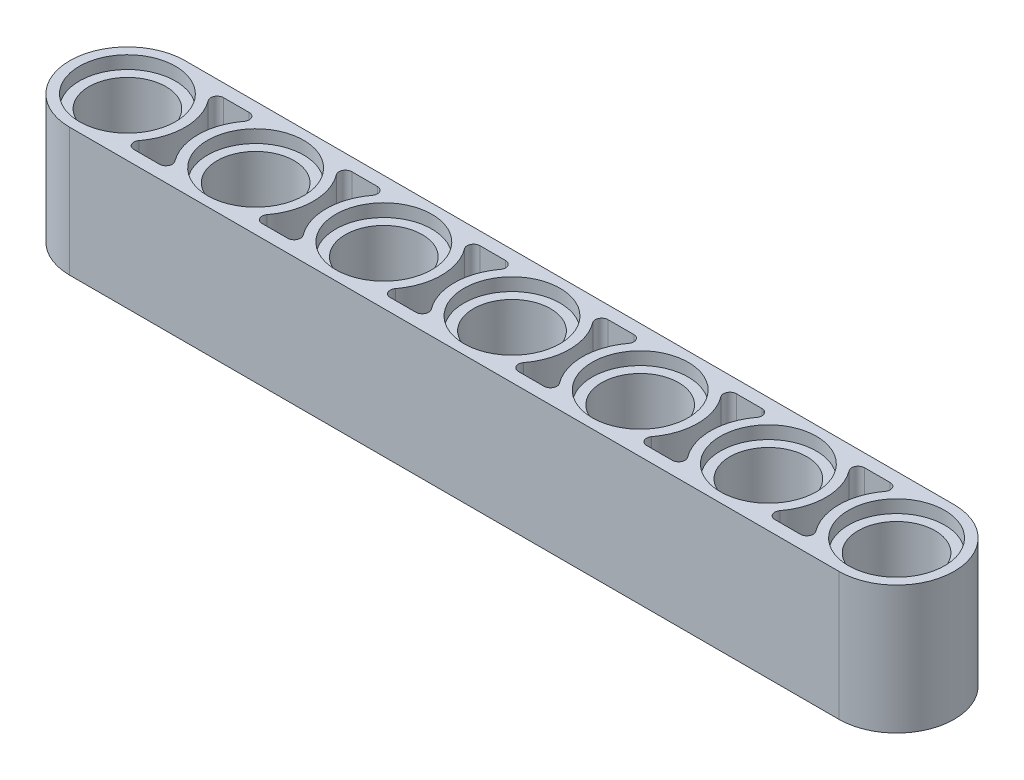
SolidWorks part; units mm, degrees
ref_plane "Front Plane" through (0, 0, 0) normal (0, 0, 1) x (1, 0, 0)
ref_plane "Top Plane" through (0, 0, 0) normal (0, 1, 0) x (1, 0, 0)
ref_plane "Right Plane" through (0, 0, 0) normal (1, 0, 0) x (0, 0, -1)
sketch "Sketch1" plane through (0, 0, 0) normal (0, 1, 0) x (1, 0, 0)
  line L0 (0, 0) -> (8, 0) construction
  line L1 (0, -3.6) -> (112, -3.6)
  line L2 (0, 3.6) -> (112, 3.6)
  circle A0 centre (0, 0) radius 2.4
  circle A1 centre (8, 0) radius 2.4
  circle A2 centre (16, 0) radius 2.4
  circle A3 centre (24, 0) radius 2.4
  circle A4 centre (32, 0) radius 2.4
  circle A5 centre (40, 0) radius 2.4
  circle A6 centre (48, 0) radius 2.4
  circle A7 centre (56, 0) radius 2.4
  circle A8 centre (64, 0) radius 2.4
  circle A9 centre (72, 0) radius 2.4
  circle A10 centre (80, 0) radius 2.4
  circle A11 centre (88, 0) radius 2.4
  circle A12 centre (96, 0) radius 2.4
  circle A13 centre (104, 0) radius 2.4
  circle A14 centre (112, 0) radius 2.4
  arc A15 (112, 3.6) -> (112, -3.6) centre (112, 0) cw
  arc A16 (0, 3.6) -> (0, -3.6) centre (0, 0) ccw
  dimension "D1" = 4.8
  dimension "D2" = 8
  dimension "D3" = 15
  dimension "D4" = 3.6
  dimension "D5" = 3.6
extrude "Boss-Extrude1" add sketch "Sketch1" along normal blind 8
sketch "Sketch2" plane through (0, 8, 0) normal (0, 1, 0) x (1, 0, 0)
  line L0 (0, 0) -> (8, 0) construction
  circle A0 centre (0, 0) radius 3
  circle A1 centre (8, 0) radius 3
  circle A2 centre (16, 0) radius 3
  circle A3 centre (24, 0) radius 3
  circle A4 centre (32, 0) radius 3
  circle A5 centre (40, 0) radius 3
  circle A6 centre (48, 0) radius 3
  circle A7 centre (56, 0) radius 3
  circle A8 centre (64, 0) radius 3
  circle A9 centre (72, 0) radius 3
  circle A10 centre (80, 0) radius 3
  circle A11 centre (88, 0) radius 3
  circle A12 centre (96, 0) radius 3
  circle A13 centre (104, 0) radius 3
  circle A14 centre (112, 0) radius 3
  dimension "D1" = 6
  dimension "D2" = 8
extrude "Cut-Extrude1" cut sketch "Sketch2" against normal blind 0.8
sketch "Sketch3" plane through (0, 8, 0) normal (0, 1, 0) x (1, 0, 0)
  line L0 (3.2, 2.8) -> (4.8, 2.8)
  line L1 (4.8, -2.8) -> (3.2, -2.8)
  line L2 (112, 3.6) -> (0, 3.6) construction
  line L3 (0, -3.6) -> (112, -3.6) construction
  line L4 (11.2, 2.8) -> (12.8, 2.8)
  line L5 (12.8, -2.8) -> (11.2, -2.8)
  line L6 (19.2, 2.8) -> (20.8, 2.8)
  line L7 (20.8, -2.8) -> (19.2, -2.8)
  line L8 (27.2, 2.8) -> (28.8, 2.8)
  line L9 (28.8, -2.8) -> (27.2, -2.8)
  line L10 (35.2, 2.8) -> (36.8, 2.8)
  line L11 (36.8, -2.8) -> (35.2, -2.8)
  line L12 (43.2, 2.8) -> (44.8, 2.8)
  line L13 (44.8, -2.8) -> (43.2, -2.8)
  line L14 (51.2, 2.8) -> (52.8, 2.8)
  line L15 (52.8, -2.8) -> (51.2, -2.8)
  line L16 (59.2, 2.8) -> (60.8, 2.8)
  line L17 (60.8, -2.8) -> (59.2, -2.8)
  line L18 (67.2, 2.8) -> (68.8, 2.8)
  line L19 (68.8, -2.8) -> (67.2, -2.8)
  line L20 (75.2, 2.8) -> (76.8, 2.8)
  line L21 (76.8, -2.8) -> (75.2, -2.8)
  line L22 (83.2, 2.8) -> (84.8, 2.8)
  line L23 (84.8, -2.8) -> (83.2, -2.8)
  line L24 (91.2, 2.8) -> (92.8, 2.8)
  line L25 (92.8, -2.8) -> (91.2, -2.8)
  line L26 (99.2, 2.8) -> (100.8, 2.8)
  line L27 (100.8, -2.8) -> (99.2, -2.8)
  line L28 (107.2, 2.8) -> (108.8, 2.8)
  line L29 (108.8, -2.8) -> (107.2, -2.8)
  line L30 (3.2, 2.8) -> (11.2, 2.8) construction
  arc A0 (2.88, -2.16) -> (2.88, 2.16) centre (0, 0) ccw
  arc A1 (5.12, 2.16) -> (5.12, -2.16) centre (8, 0) ccw
  arc A2 (3.2, -2.8) -> (2.88, -2.16) centre (3.2, -2.4) cw
  arc A3 (5.12, -2.16) -> (4.8, -2.8) centre (4.8, -2.4) cw
  arc A4 (5.12, 2.16) -> (4.8, 2.8) centre (4.8, 2.4) ccw
  arc A5 (3.2, 2.8) -> (2.88, 2.16) centre (3.2, 2.4) ccw
  arc A6 (10.88, -2.16) -> (10.88, 2.16) centre (8, 0) ccw
  arc A7 (13.12, 2.16) -> (13.12, -2.16) centre (16, 0) ccw
  arc A8 (11.2, -2.8) -> (10.88, -2.16) centre (11.2, -2.4) cw
  arc A9 (13.12, -2.16) -> (12.8, -2.8) centre (12.8, -2.4) cw
  arc A10 (13.12, 2.16) -> (12.8, 2.8) centre (12.8, 2.4) ccw
  arc A11 (11.2, 2.8) -> (10.88, 2.16) centre (11.2, 2.4) ccw
  arc A12 (18.88, -2.16) -> (18.88, 2.16) centre (16, 0) ccw
  arc A13 (21.12, 2.16) -> (21.12, -2.16) centre (24, 0) ccw
  arc A14 (19.2, -2.8) -> (18.88, -2.16) centre (19.2, -2.4) cw
  arc A15 (21.12, -2.16) -> (20.8, -2.8) centre (20.8, -2.4) cw
  arc A16 (21.12, 2.16) -> (20.8, 2.8) centre (20.8, 2.4) ccw
  arc A17 (19.2, 2.8) -> (18.88, 2.16) centre (19.2, 2.4) ccw
  arc A18 (26.88, -2.16) -> (26.88, 2.16) centre (24, 0) ccw
  arc A19 (29.12, 2.16) -> (29.12, -2.16) centre (32, 0) ccw
  arc A20 (27.2, -2.8) -> (26.88, -2.16) centre (27.2, -2.4) cw
  arc A21 (29.12, -2.16) -> (28.8, -2.8) centre (28.8, -2.4) cw
  arc A22 (29.12, 2.16) -> (28.8, 2.8) centre (28.8, 2.4) ccw
  arc A23 (27.2, 2.8) -> (26.88, 2.16) centre (27.2, 2.4) ccw
  arc A24 (34.88, -2.16) -> (34.88, 2.16) centre (32, 0) ccw
  arc A25 (37.12, 2.16) -> (37.12, -2.16) centre (40, 0) ccw
  arc A26 (35.2, -2.8) -> (34.88, -2.16) centre (35.2, -2.4) cw
  arc A27 (37.12, -2.16) -> (36.8, -2.8) centre (36.8, -2.4) cw
  arc A28 (37.12, 2.16) -> (36.8, 2.8) centre (36.8, 2.4) ccw
  arc A29 (35.2, 2.8) -> (34.88, 2.16) centre (35.2, 2.4) ccw
  arc A30 (42.88, -2.16) -> (42.88, 2.16) centre (40, 0) ccw
  arc A31 (45.12, 2.16) -> (45.12, -2.16) centre (48, 0) ccw
  arc A32 (43.2, -2.8) -> (42.88, -2.16) centre (43.2, -2.4) cw
  arc A33 (45.12, -2.16) -> (44.8, -2.8) centre (44.8, -2.4) cw
  arc A34 (45.12, 2.16) -> (44.8, 2.8) centre (44.8, 2.4) ccw
  arc A35 (43.2, 2.8) -> (42.88, 2.16) centre (43.2, 2.4) ccw
  arc A36 (50.88, -2.16) -> (50.88, 2.16) centre (48, 0) ccw
  arc A37 (53.12, 2.16) -> (53.12, -2.16) centre (56, 0) ccw
  arc A38 (51.2, -2.8) -> (50.88, -2.16) centre (51.2, -2.4) cw
  arc A39 (53.12, -2.16) -> (52.8, -2.8) centre (52.8, -2.4) cw
  arc A40 (53.12, 2.16) -> (52.8, 2.8) centre (52.8, 2.4) ccw
  arc A41 (51.2, 2.8) -> (50.88, 2.16) centre (51.2, 2.4) ccw
  arc A42 (58.88, -2.16) -> (58.88, 2.16) centre (56, 0) ccw
  arc A43 (61.12, 2.16) -> (61.12, -2.16) centre (64, 0) ccw
  arc A44 (59.2, -2.8) -> (58.88, -2.16) centre (59.2, -2.4) cw
  arc A45 (61.12, -2.16) -> (60.8, -2.8) centre (60.8, -2.4) cw
  arc A46 (61.12, 2.16) -> (60.8, 2.8) centre (60.8, 2.4) ccw
  arc A47 (59.2, 2.8) -> (58.88, 2.16) centre (59.2, 2.4) ccw
  arc A48 (66.88, -2.16) -> (66.88, 2.16) centre (64, 0) ccw
  arc A49 (69.12, 2.16) -> (69.12, -2.16) centre (72, 0) ccw
  arc A50 (67.2, -2.8) -> (66.88, -2.16) centre (67.2, -2.4) cw
  arc A51 (69.12, -2.16) -> (68.8, -2.8) centre (68.8, -2.4) cw
  arc A52 (69.12, 2.16) -> (68.8, 2.8) centre (68.8, 2.4) ccw
  arc A53 (67.2, 2.8) -> (66.88, 2.16) centre (67.2, 2.4) ccw
  arc A54 (74.88, -2.16) -> (74.88, 2.16) centre (72, 0) ccw
  arc A55 (77.12, 2.16) -> (77.12, -2.16) centre (80, 0) ccw
  arc A56 (75.2, -2.8) -> (74.88, -2.16) centre (75.2, -2.4) cw
  arc A57 (77.12, -2.16) -> (76.8, -2.8) centre (76.8, -2.4) cw
  arc A58 (77.12, 2.16) -> (76.8, 2.8) centre (76.8, 2.4) ccw
  arc A59 (75.2, 2.8) -> (74.88, 2.16) centre (75.2, 2.4) ccw
  arc A60 (82.88, -2.16) -> (82.88, 2.16) centre (80, 0) ccw
  arc A61 (85.12, 2.16) -> (85.12, -2.16) centre (88, 0) ccw
  arc A62 (83.2, -2.8) -> (82.88, -2.16) centre (83.2, -2.4) cw
  arc A63 (85.12, -2.16) -> (84.8, -2.8) centre (84.8, -2.4) cw
  arc A64 (85.12, 2.16) -> (84.8, 2.8) centre (84.8, 2.4) ccw
  arc A65 (83.2, 2.8) -> (82.88, 2.16) centre (83.2, 2.4) ccw
  arc A66 (90.88, -2.16) -> (90.88, 2.16) centre (88, 0) ccw
  arc A67 (93.12, 2.16) -> (93.12, -2.16) centre (96, 0) ccw
  arc A68 (91.2, -2.8) -> (90.88, -2.16) centre (91.2, -2.4) cw
  arc A69 (93.12, -2.16) -> (92.8, -2.8) centre (92.8, -2.4) cw
  arc A70 (93.12, 2.16) -> (92.8, 2.8) centre (92.8, 2.4) ccw
  arc A71 (91.2, 2.8) -> (90.88, 2.16) centre (91.2, 2.4) ccw
  arc A72 (98.88, -2.16) -> (98.88, 2.16) centre (96, 0) ccw
  arc A73 (101.12, 2.16) -> (101.12, -2.16) centre (104, 0) ccw
  arc A74 (99.2, -2.8) -> (98.88, -2.16) centre (99.2, -2.4) cw
  arc A75 (101.12, -2.16) -> (100.8, -2.8) centre (100.8, -2.4) cw
  arc A76 (101.12, 2.16) -> (100.8, 2.8) centre (100.8, 2.4) ccw
  arc A77 (99.2, 2.8) -> (98.88, 2.16) centre (99.2, 2.4) ccw
  arc A78 (106.88, -2.16) -> (106.88, 2.16) centre (104, 0) ccw
  arc A79 (109.12, 2.16) -> (109.12, -2.16) centre (112, 0) ccw
  arc A80 (107.2, -2.8) -> (106.88, -2.16) centre (107.2, -2.4) cw
  arc A81 (109.12, -2.16) -> (108.8, -2.8) centre (108.8, -2.4) cw
  arc A82 (109.12, 2.16) -> (108.8, 2.8) centre (108.8, 2.4) ccw
  arc A83 (107.2, 2.8) -> (106.88, 2.16) centre (107.2, 2.4) ccw
  dimension "D3" = 0.4
  dimension "D1" = 0.8
  dimension "D2" = 0.8
  dimension "D4" = 8
extrude "Cut-Extrude2" cut sketch "Sketch3" against normal blind 3.2
ref_plane "Plane1" through (0, 4, 0) normal (0, 1, 0) x (1, 0, 0)
mirror "Mirror1" about plane through (0, 4, 0) normal (0, 1, 0) of "Cut-Extrude2", "Cut-Extrude1"
sketch "Sketch4" plane through (0, 8, 0) normal (0, 1, 0) x (1, 0, 0)
  line L0 (96, 3.6) -> (112, 3.6)
  line L1 (112, -3.6) -> (96, -3.6)
  arc A0 (96, -3.6) -> (96, 3.6) centre (96, 0) ccw
  arc A1 (112, -3.6) -> (112, 3.6) centre (112, 0) ccw construction
  arc A2 (112, -3.6) -> (112, 3.6) centre (112, 0) ccw
extrude "Cut-Extrude3" cut sketch "Sketch4" against normal up to surface (8 mm away)
sketch "Sketch5" plane through (0, 8, 0) normal (0, 1, 0) x (1, 0, 0)
  line L1 (80, 3.6) -> (96, 3.6)
  line L2 (80, -3.6) -> (96, -3.6)
  arc A1 (96, -3.6) -> (96, 3.6) centre (96, 0) ccw
  arc A2 (80, 3.6) -> (80, -3.6) centre (80, 0) cw
  point P4 (88, 0)
extrude "Cut-Extrude4" cut sketch "Sketch5" against normal up to surface (8 mm away)
sketch "Sketch6" plane through (0, 8, 0) normal (0, 1, 0) x (1, 0, 0)
  line L0 (64, 3.6) -> (80, 3.6)
  line L2 (80, -3.6) -> (64, -3.6)
  arc A0 (64, -3.6) -> (64, 3.6) centre (64, 0) ccw
  arc A1 (80, 3.6) -> (80, -3.6) centre (80, 0) cw
extrude "Cut-Extrude5" cut sketch "Sketch6" against normal up to surface (8 mm away)
sketch "Sketch7" plane through (0, 8, 0) normal (0, 1, 0) x (1, 0, 0)
  line L0 (48, 3.6) -> (64, 3.6)
  line L2 (64, -3.6) -> (48, -3.6)
  arc A0 (48, -3.6) -> (48, 3.6) centre (48, 0) ccw
  arc A1 (64, 3.6) -> (64, -3.6) centre (64, 0) cw
extrude "Cut-Extrude6" cut sketch "Sketch7" against normal up to surface (8 mm away)
